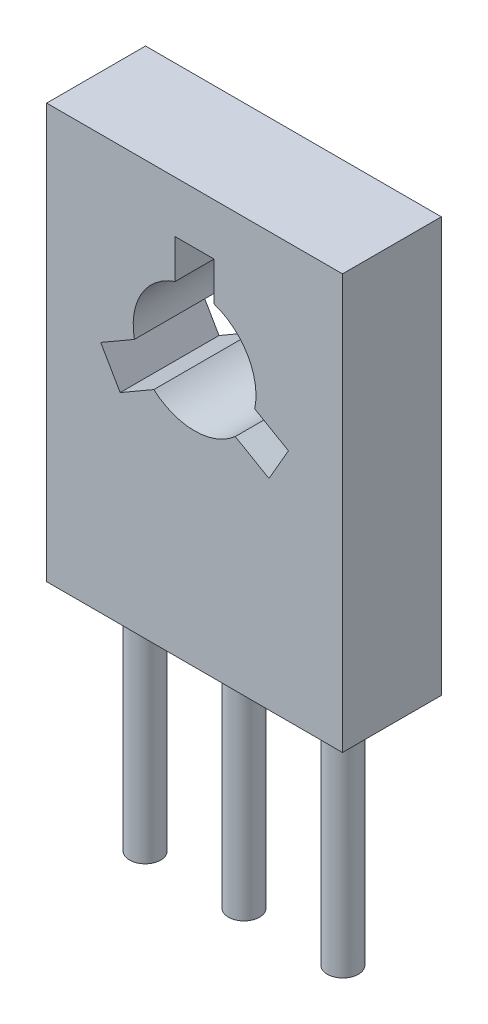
SolidWorks part; units mm, degrees
ref_plane "Face" through (0, 0, 0) normal (0, 0, 1) x (1, 0, 0)
ref_plane "Dessus" through (0, 0, 0) normal (0, 1, 0) x (1, 0, 0)
ref_plane "Droite" through (0, 0, 0) normal (1, 0, 0) x (0, 0, -1)
sketch "Esquisse1" plane through (0, 0, 0) normal (0, 0, 1) x (1, 0, 0)
  line L1 (-21.9012, 5.7776) -> (-14.3012, 5.7776)
  line L2 (-21.9012, 5.7776) -> (-21.9012, 16.4276)
  line L3 (-21.9012, 16.4276) -> (-14.3012, 16.4276)
  line L4 (-14.3012, 5.7776) -> (-14.3012, 16.4276)
  dimension "D1" = 10.65
  dimension "D2" = 7.6
extrude "Extrusion1" add sketch "Esquisse1" along normal blind 2.54
sketch "Esquisse2" plane through (0, 0, 2.54) normal (0, 0, 1) x (1, 0, 0)
  line L0 (-18.1012, 16.4276) -> (-18.1012, 5.7776) construction
  line L1 (-14.3012, 16.4276) -> (-21.9012, 16.4276) construction
  line L2 (-21.9012, 5.7776) -> (-14.3012, 5.7776) construction
  line L3 (-18.6012, 15.1075) -> (-17.6012, 15.1075)
  line L4 (-17.6012, 15.1075) -> (-17.6012, 14.1075)
  line L5 (-18.6012, 15.1075) -> (-18.6012, 14.1075)
  line L6 (-18.1012, 12.6114) -> (-21.1151, 10.8713) construction
  line L7 (-18.1012, 12.6114) -> (-15.5614, 11.145) construction
  line L8 (-20.5129, 11.7963) -> (-20.0129, 10.9303)
  line L9 (-16.1895, 10.9303) -> (-15.6895, 11.7963)
  line L10 (-20.0129, 10.9303) -> (-19.1469, 11.4303)
  line L11 (-20.5129, 11.7963) -> (-19.6469, 12.2963)
  line L12 (-16.1895, 10.9303) -> (-17.0555, 11.4303)
  line L13 (-15.6895, 11.7963) -> (-16.5555, 12.2963)
  arc A0 (-17.6012, 14.1075) -> (-16.5555, 12.2963) centre (-18.1012, 12.6114) cw
  arc A1 (-18.6012, 14.1075) -> (-19.6469, 12.2963) centre (-18.1012, 12.6114) ccw
  arc A2 (-19.1469, 11.4303) -> (-17.0555, 11.4303) centre (-18.1012, 12.6114) ccw
  dimension "D3" = 1
  dimension "D4" = 60
  dimension "D5" = 1
extrude "Enlèv. mat.-Extru.1" cut sketch "Esquisse2" against normal through all
sketch "Esquisse3" plane through (0, 5.7776, 0) normal (0, -1, 0) x (1, 0, 0)
  line L0 (-21.9012, 1.27) -> (-14.3012, 1.27) construction
  line L1 (-21.9012, 2.54) -> (-21.9012, 0) construction
  line L2 (-14.3012, 2.54) -> (-14.3012, 0) construction
  line L3 (-18.1012, 2.54) -> (-18.1012, 0) construction
  line L4 (-21.9012, 2.54) -> (-14.3012, 2.54) construction
  line L5 (-21.9012, 0) -> (-14.3012, 0) construction
  circle A0 centre (-18.1012, 1.27) radius 0.4
  circle A1 centre (-20.6412, 1.27) radius 0.4
  circle A2 centre (-15.5612, 1.27) radius 0.4
  dimension "D1" = 0.8
  dimension "D2" = 2.54
extrude "Extrusion2" add sketch "Esquisse3" along normal blind 6
